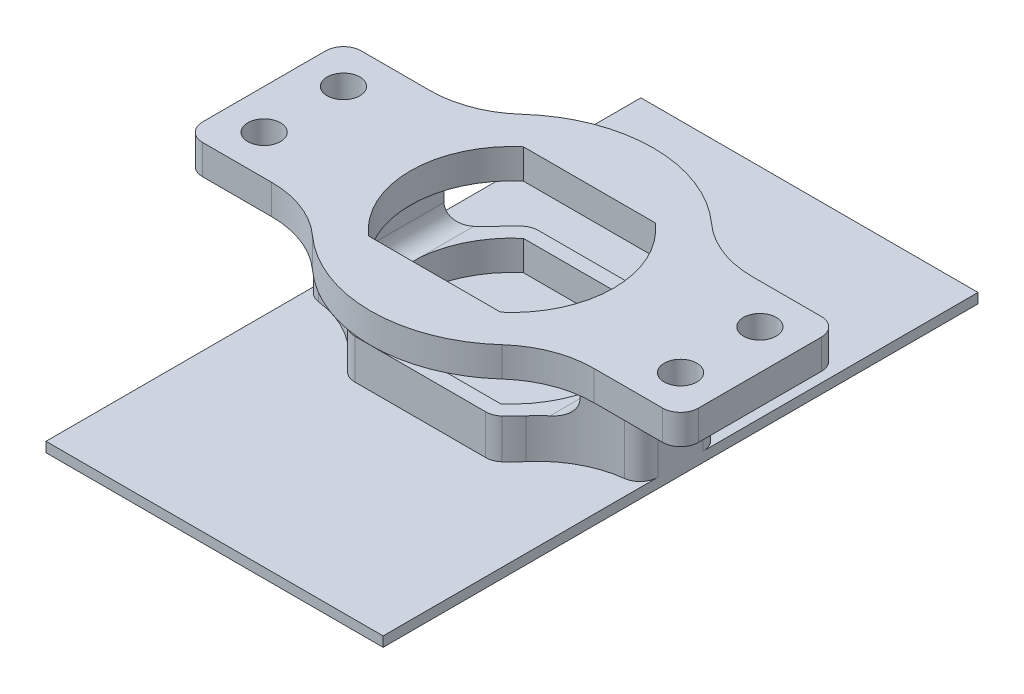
SolidWorks part; units mm, degrees
ref_plane "Front Plane" through (0, 0, 0) normal (0, 0, 1) x (1, 0, 0)
ref_plane "Top Plane" through (0, 0, 0) normal (0, 1, 0) x (1, 0, 0)
ref_plane "Right Plane" through (0, 0, 0) normal (1, 0, 0) x (0, 0, -1)
sketch "Sketch2" plane through (0, 0, 0) normal (0, 1, 0) x (1, 0, 0)
  line L0 (-11.7925, 8) -> (-25, 8)
  line L1 (-25, 8) -> (-25, -8)
  line L2 (-25, -8) -> (-11.7925, -8)
  line L3 (0, 0) -> (-57.2807, 0) construction
  line L4 (-55, 0) -> (55, 0) construction
  line L5 (11.7925, 8) -> (25, 8)
  line L6 (25, 8) -> (25, -8)
  line L7 (25, -8) -> (11.7925, -8)
  line L8 (0, 0) -> (0, 7.8) construction
  line L9 (0, -55) -> (0, 55) construction
  line L10 (-6.65, 7.8) -> (6.65, 7.8)
  line L11 (-6.65, -7.8) -> (6.65, -7.8)
  line L12 (0, 10.05) -> (0, 43.4315) construction
  line L13 (-21, 8) -> (-21, -8) construction
  line L14 (21, 8) -> (21, -8) construction
  arc A0 (-6.65, 7.8) -> (-6.65, -7.8) centre (0, 0) ccw
  arc A1 (-11.7925, -8) -> (11.7925, -8) centre (0, 0) ccw
  arc A2 (11.7925, 8) -> (-11.7925, 8) centre (0, 0) ccw
  arc A5 (6.65, -7.8) -> (6.65, 7.8) centre (0, 0) ccw
  circle A6 centre (-21, 4) radius 1.65
  circle A7 centre (-21, -4) radius 1.65
  circle A8 centre (21, 4) radius 1.65
  circle A9 centre (21, -4) radius 1.65
  dimension "D1" = 20.5
  dimension "D2" = 4
  dimension "D5" = 21
  dimension "D8" = 3.3
  dimension "D3" = 50
  dimension "D4" = 16
  dimension "D6" = 21
  dimension "D7" = 15.6
  dimension "D9" = 4
extrude "Boss-Extrude1" add sketch "Sketch2" along normal blind 3
sketch "Sketch4" plane through (0, 0, 0) normal (0, 0, 1) x (1, 0, 0)
  line L0 (0, -2.75) -> (0, 2.75) construction
  line L1 (-1, -2.765) -> (1, -2.765)
  line L2 (-1, -2.765) -> (-1, 7.8736)
  line L3 (-1, 7.8736) -> (1, 7.8736)
  line L4 (1, -2.765) -> (1, 7.8736)
  line L5 (-1, -2.765) -> (1, 7.8736) construction
  line L6 (-1, 7.8736) -> (1, -2.765) construction
  point P0 (0, 2.5543)
  dimension "D1" = 2
sketch "Sketch6" plane through (0, 0, 0) normal (1, 0, 0) x (0, 0, -1)
  line L0 (0, 2.75) -> (0, -2.75) construction
  line L1 (-18.3557, -5.0314) -> (18.3557, -5.0314)
  line L2 (-18.3557, -5.0314) -> (-18.3557, 9.6401)
  line L3 (-18.3557, 9.6401) -> (18.3557, 9.6401)
  line L4 (18.3557, -5.0314) -> (18.3557, 9.6401)
  line L5 (-18.3557, -5.0314) -> (18.3557, 9.6401) construction
  line L6 (-18.3557, 9.6401) -> (18.3557, -5.0314) construction
  point P0 (0, 2.3044)
sketch "Sketch7" plane through (0, 0, 0) normal (0, -1, 0) x (1, 0, 0)
  line L0 (55, 0) -> (-55, 0) construction
  line L1 (-12, -4) -> (-17, -4)
  line L2 (-12, -4) -> (-12, 4)
  line L3 (-12, 4) -> (-17, 4)
  line L4 (-17, -4) -> (-17, 4)
  line L5 (-12, -4) -> (-17, 4) construction
  line L6 (-12, 4) -> (-17, -4) construction
  line L7 (-25, -8) -> (-25, 8) construction
  point P0 (-14.5, 0)
  dimension "D1" = 8
  dimension "D2" = 5
  dimension "D3" = 8
extrude "Boss-Extrude2" add sketch "Sketch7" along normal blind 10
mirror "Mirror1" about plane through (0, 0, 0) normal (1, 0, 0) of "Boss-Extrude2"
ref_plane "Plane3" through (0, -5, 0) normal (0, 1, 0) x (1, 0, 0)
sketch "Sketch8" plane through (0, -5, 0) normal (0, 1, 0) x (1, 0, 0)
  line L0 (-7.2457, -9.25) -> (7.2457, -9.25)
  line L1 (-7.2457, 9.25) -> (7.2457, 9.25)
  line L2 (-17, 4) -> (-12, 4) construction
  line L3 (-17, -4) -> (-12, -4)
  line L4 (-17, -4) -> (-17, 4)
  line L5 (-17, 4) -> (-12, 4)
  line L7 (-12, -4) -> (-11.0482, -4)
  line L8 (12, -4) -> (17, -4)
  line L10 (12, 4) -> (17, 4)
  line L11 (17, -4) -> (17, 4)
  line L12 (-12, 4) -> (-11.0482, 4)
  line L13 (12, -4) -> (11.0482, -4)
  line L14 (12, 4) -> (11.0482, 4)
  line L15 (0, 0) -> (32.0131, 0) construction
  line L16 (-7.15, 0) -> (7.15, 0) construction
  arc A0 (7.2457, -9.25) -> (11.0482, -4) centre (0, 0) ccw
  arc A1 (-7.2457, 9.25) -> (-11.0482, 4) centre (0, 0) ccw
  arc A2 (-11.0482, -4) -> (-7.2457, -9.25) centre (0, 0) ccw
  arc A3 (11.0482, 4) -> (7.2457, 9.25) centre (0, 0) ccw
  dimension "D1" = 23.5
  dimension "D2" = 18.5
extrude "Boss-Extrude3" add sketch "Sketch8" against normal blind 5
fillet "Fillet1" radius 10 8 edges at (-11.7925, 1.5, -8) (-11.7925, 1.5, 8) (11.7925, 1.5, 8) (11.7925, 1.5, -8) (-11.0482, -7.5, 4) (11.0482, -7.5, 4) (11.0482, -7.5, -4) (-11.0482, -7.5, -4)
fillet "Fillet2" radius 1.8 14 edges at (-25, 1.5, -8) (-25, 1.5, 8) (25, 1.5, -8) (25, 1.5, 8) (-7.2457, -7.5, 9.25) (7.2457, -7.5, 9.25) (-7.2457, -7.5, -9.25) (7.2457, -7.5, -9.25) (17, -5, -4) (17, -5, 4) (-17, -5, -4) (-17, -5, 4) (-12, -5, 0) (12, -5, 0)
sketch "Sketch9" plane through (0, -5, 0) normal (0, 1, 0) x (1, 0, 0)
  line L0 (-6.65, 7.8) -> (6.65, 7.8)
  line L1 (-6.65, -7.8) -> (6.65, -7.8)
  line L2 (0, 0) -> (29.725, 0) construction
  line L3 (-7.15, 0) -> (7.15, 0) construction
  arc A0 (-6.65, 7.8) -> (-6.65, -7.8) centre (0, 0) ccw
  arc A1 (6.65, -7.8) -> (6.65, 7.8) centre (0, 0) ccw
  dimension "D1" = 20.5
  dimension "D2" = 15.6
extrude "Cut-Extrude1" cut sketch "Sketch9" against normal blind 3
sketch "Sketch10" plane through (0, -10, 0) normal (0, -1, 0) x (1, 0, 0)
  circle A0 centre (0, 0) radius 3.1
  dimension "D1" = 6.2
extrude "Cut-Extrude2" [suppressed] cut sketch "Sketch10" against normal up to next
fillet "Fillet4" radius 1.8 12 edges at (13.6619, 0, -4.4554) (16.5485, 0, -3.4811) (17, 0, 0) (16.5485, 0, 3.4811) (-13.6619, 0, -4.4554) (-16.5485, 0, -3.4811) (-17, 0, 0) (-16.5485, 0, 3.4811) (12, 0, 0) (13.6619, 0, 4.4554) (-12, 0, 0) (-13.6619, 0, 4.4554)
fillet "Fillet5" radius 1 20 edges at (-8.4131, -10, 8.2026) (-7.2334, -10, 9.1331) (0, -10, 9.25) (7.2334, -10, 9.1331) (8.4131, -10, 8.2026) (11.876, -10, 5.2105) (16.5485, -10, 3.4811) (16.5485, -10, -3.4811) (11.876, -10, -5.2105) (8.4131, -10, -8.2026) (7.2334, -10, -9.1331) (0, -10, -9.25) (-7.2334, -10, -9.1331) (-8.4131, -10, -8.2026) (-11.876, -10, -5.2105) (-16.5485, -10, -3.4811) (-16.5485, -10, 3.4811) (-11.876, -10, 5.2105) (17, -10, 0) (-17, -10, 0)
sketch "Sketch11" plane through (0, -10, 0) normal (0, -1, 0) x (1, 0, 0)
  line L1 (-17, -30) -> (17, -30)
  line L2 (-17, -30) -> (-17, 30)
  line L3 (-17, 30) -> (17, 30)
  line L4 (17, -30) -> (17, 30)
  line L5 (-17, -30) -> (17, 30) construction
  line L6 (-17, 30) -> (17, -30) construction
  point P0 (0, 0)
  dimension "D1" = 34
  dimension "D2" = 60
extrude "Boss-Extrude4" add sketch "Sketch11" against normal blind 1
